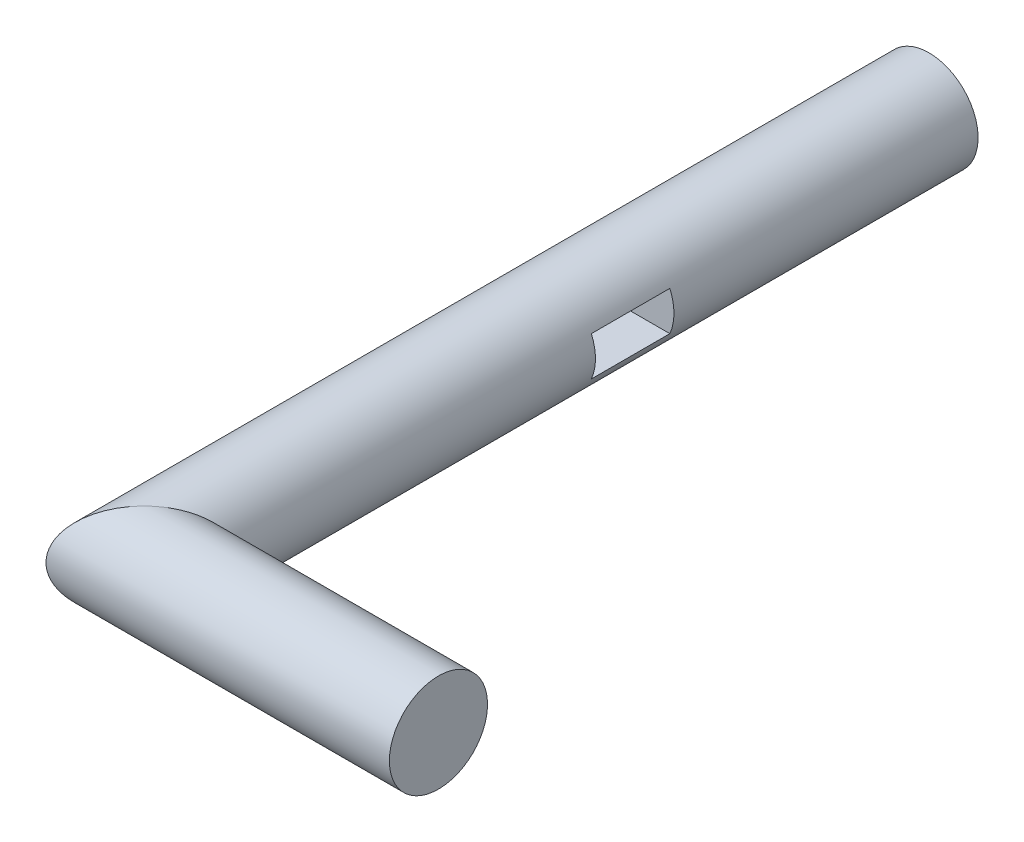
SolidWorks part; units mm, degrees
ref_plane "Front Plane" through (0, 0, 0) normal (0, 0, 1) x (1, 0, 0)
ref_plane "Top Plane" through (0, 0, 0) normal (0, 1, 0) x (1, 0, 0)
ref_plane "Right Plane" through (0, 0, 0) normal (1, 0, 0) x (0, 0, -1)
sketch "Sketch2" plane through (0, 0, 0) normal (0, 1, 0) x (1, 0, 0)
  line L0 (0, -10) -> (0, 70)
  line L2 (0, -10) -> (30, -10)
  point P7 (0, -10)
  dimension "D1" = 10
  dimension "D2" = 70
  dimension "D3" = 30
sweep "Sweep2" add path "Sketch2" parameters "D3"=10
sketch "Sketch4" plane through (0, 0, 0) normal (1, 0, 0) x (0, 0, -1)
  line L0 (35, -2) -> (35, 2) construction
  line L1 (31, 2) -> (39, 2)
  line L2 (31, 2) -> (31, -2)
  line L3 (31, -2) -> (39, -2)
  line L4 (39, 2) -> (39, -2)
  line L5 (0, 0) -> (0, 3.5037) construction
  line L6 (70, 0) -> (70, 4.3086) construction
  line L7 (70, -5) -> (70, 5) construction
  line L8 (0, 0) -> (35, 0) construction
  line L9 (35, 0) -> (70, 0) construction
  point P4 (31, 0)
  dimension "D1" = 4
  dimension "D2" = 8
extrude "Cut-Extrude1" cut sketch "Sketch4" against normal through all both and the other way through all
